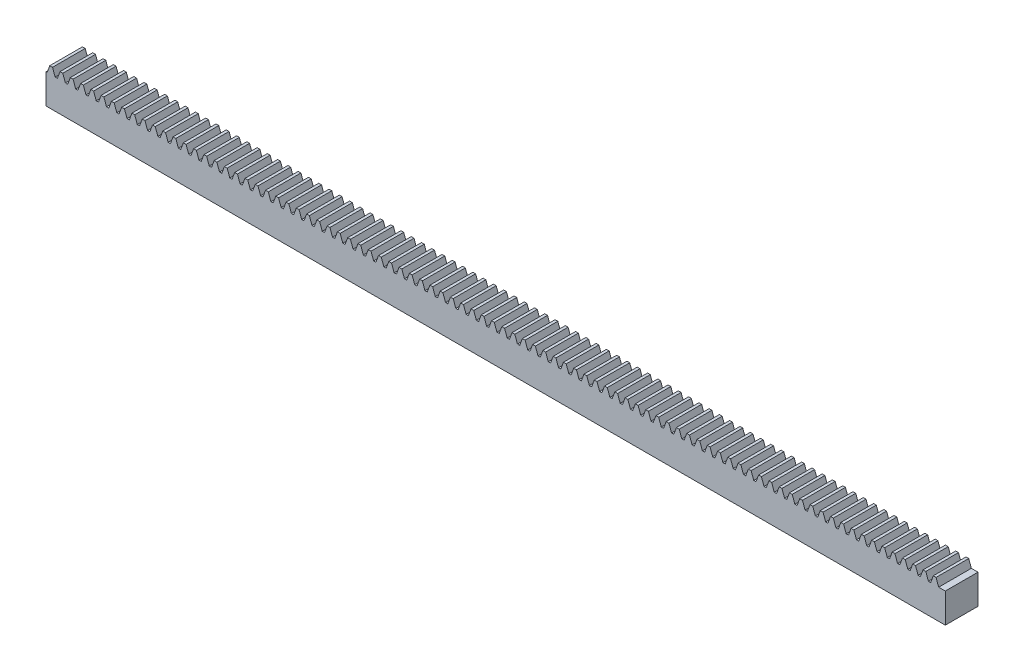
SolidWorks part; units mm, degrees
ref_plane "Plan de face" through (0, 0, 0) normal (0, 0, 1) x (1, 0, 0)
ref_plane "Plan de dessus" through (0, 0, 0) normal (0, 1, 0) x (1, 0, 0)
ref_plane "Plan de droite" through (0, 0, 0) normal (1, 0, 0) x (0, 0, -1)
ref_plane "Plan1" through (0, 0, 40) normal (0, 0, 1) x (1, 0, 0)
sketch "Esquisse1" plane through (0, 0, 40) normal (0, 0, 1) x (1, 0, 0)
  line L0 (0, 0) -> (1005, 0)
  line L1 (1005, 0) -> (1005, 62.4)
  line L2 (1005, 62.4) -> (987.299, 62.4)
  line L3 (987.299, 62.4) -> (980.8931, 80)
  line L4 (980.8931, 80) -> (974.1503, 80)
  line L5 (974.1503, 80) -> (967.7444, 62.4)
  line L6 (967.7444, 62.4) -> (962.1663, 62.4)
  line L7 (962.1663, 62.4) -> (955.7604, 80)
  line L8 (955.7604, 80) -> (949.0175, 80)
  line L9 (949.0175, 80) -> (942.6117, 62.4)
  line L10 (942.6117, 62.4) -> (937.0335, 62.4)
  line L11 (937.0335, 62.4) -> (930.6277, 80)
  line L12 (930.6277, 80) -> (923.8848, 80)
  line L13 (923.8848, 80) -> (917.4789, 62.4)
  line L14 (917.4789, 62.4) -> (911.9008, 62.4)
  line L15 (911.9008, 62.4) -> (905.4949, 80)
  line L16 (905.4949, 80) -> (898.7521, 80)
  line L17 (898.7521, 80) -> (892.3462, 62.4)
  line L18 (892.3462, 62.4) -> (886.7681, 62.4)
  line L19 (886.7681, 62.4) -> (880.3622, 80)
  line L20 (880.3622, 80) -> (873.6194, 80)
  line L21 (873.6194, 80) -> (867.2135, 62.4)
  line L22 (867.2135, 62.4) -> (861.6354, 62.4)
  line L23 (861.6354, 62.4) -> (855.2295, 80)
  line L24 (855.2295, 80) -> (848.4867, 80)
  line L25 (848.4867, 80) -> (842.0808, 62.4)
  line L26 (842.0808, 62.4) -> (836.5027, 62.4)
  line L27 (836.5027, 62.4) -> (830.0968, 80)
  line L28 (830.0968, 80) -> (823.3539, 80)
  line L29 (823.3539, 80) -> (816.9481, 62.4)
  line L30 (816.9481, 62.4) -> (811.3699, 62.4)
  line L31 (811.3699, 62.4) -> (804.9641, 80)
  line L32 (804.9641, 80) -> (798.2212, 80)
  line L33 (798.2212, 80) -> (791.8153, 62.4)
  line L34 (791.8153, 62.4) -> (786.2372, 62.4)
  line L35 (786.2372, 62.4) -> (779.8313, 80)
  line L36 (779.8313, 80) -> (773.0885, 80)
  line L37 (773.0885, 80) -> (766.6826, 62.4)
  line L38 (766.6826, 62.4) -> (761.1045, 62.4)
  line L39 (761.1045, 62.4) -> (754.6986, 80)
  line L40 (754.6986, 80) -> (747.9558, 80)
  line L41 (747.9558, 80) -> (741.5499, 62.4)
  line L42 (741.5499, 62.4) -> (735.9718, 62.4)
  line L43 (735.9718, 62.4) -> (729.5659, 80)
  line L44 (729.5659, 80) -> (722.8231, 80)
  line L45 (722.8231, 80) -> (716.4172, 62.4)
  line L46 (716.4172, 62.4) -> (710.8391, 62.4)
  line L47 (710.8391, 62.4) -> (704.4332, 80)
  line L48 (704.4332, 80) -> (697.6903, 80)
  line L49 (697.6903, 80) -> (691.2845, 62.4)
  line L50 (691.2845, 62.4) -> (685.7063, 62.4)
  line L51 (685.7063, 62.4) -> (679.3005, 80)
  line L52 (679.3005, 80) -> (672.5576, 80)
  line L53 (672.5576, 80) -> (666.1517, 62.4)
  line L54 (666.1517, 62.4) -> (660.5736, 62.4)
  line L55 (660.5736, 62.4) -> (654.1677, 80)
  line L56 (654.1677, 80) -> (647.4249, 80)
  line L57 (647.4249, 80) -> (641.019, 62.4)
  line L58 (641.019, 62.4) -> (635.4409, 62.4)
  line L59 (635.4409, 62.4) -> (629.035, 80)
  line L60 (629.035, 80) -> (622.2922, 80)
  line L61 (622.2922, 80) -> (615.8863, 62.4)
  line L62 (615.8863, 62.4) -> (610.3082, 62.4)
  line L63 (610.3082, 62.4) -> (603.9023, 80)
  line L64 (603.9023, 80) -> (597.1595, 80)
  line L65 (597.1595, 80) -> (590.7536, 62.4)
  line L66 (590.7536, 62.4) -> (585.1755, 62.4)
  line L67 (585.1755, 62.4) -> (578.7696, 80)
  line L68 (578.7696, 80) -> (572.0267, 80)
  line L69 (572.0267, 80) -> (565.6209, 62.4)
  line L70 (565.6209, 62.4) -> (560.0427, 62.4)
  line L71 (560.0427, 62.4) -> (553.6369, 80)
  line L72 (553.6369, 80) -> (546.894, 80)
  line L73 (546.894, 80) -> (540.4881, 62.4)
  line L74 (540.4881, 62.4) -> (534.91, 62.4)
  line L75 (534.91, 62.4) -> (528.5041, 80)
  line L76 (528.5041, 80) -> (521.7613, 80)
  line L77 (521.7613, 80) -> (515.3554, 62.4)
  line L78 (515.3554, 62.4) -> (509.7773, 62.4)
  line L79 (509.7773, 62.4) -> (503.3714, 80)
  line L80 (503.3714, 80) -> (496.6286, 80)
  line L81 (496.6286, 80) -> (490.2227, 62.4)
  line L82 (490.2227, 62.4) -> (484.6446, 62.4)
  line L83 (484.6446, 62.4) -> (478.2387, 80)
  line L84 (478.2387, 80) -> (471.4959, 80)
  line L85 (471.4959, 80) -> (465.09, 62.4)
  line L86 (465.09, 62.4) -> (459.5119, 62.4)
  line L87 (459.5119, 62.4) -> (453.106, 80)
  line L88 (453.106, 80) -> (446.3631, 80)
  line L89 (446.3631, 80) -> (439.9573, 62.4)
  line L90 (439.9573, 62.4) -> (434.3791, 62.4)
  line L91 (434.3791, 62.4) -> (427.9733, 80)
  line L92 (427.9733, 80) -> (421.2304, 80)
  line L93 (421.2304, 80) -> (414.8245, 62.4)
  line L94 (414.8245, 62.4) -> (409.2464, 62.4)
  line L95 (409.2464, 62.4) -> (402.8405, 80)
  line L96 (402.8405, 80) -> (396.0977, 80)
  line L97 (396.0977, 80) -> (389.6918, 62.4)
  line L98 (389.6918, 62.4) -> (384.1137, 62.4)
  line L99 (384.1137, 62.4) -> (377.7078, 80)
  line L100 (377.7078, 80) -> (370.965, 80)
  line L101 (370.965, 80) -> (364.5591, 62.4)
  line L102 (364.5591, 62.4) -> (358.981, 62.4)
  line L103 (358.981, 62.4) -> (352.5751, 80)
  line L104 (352.5751, 80) -> (345.8323, 80)
  line L105 (345.8323, 80) -> (339.4264, 62.4)
  line L106 (339.4264, 62.4) -> (333.8483, 62.4)
  line L107 (333.8483, 62.4) -> (327.4424, 80)
  line L108 (327.4424, 80) -> (320.6995, 80)
  line L109 (320.6995, 80) -> (314.2937, 62.4)
  line L110 (314.2937, 62.4) -> (308.7155, 62.4)
  line L111 (308.7155, 62.4) -> (302.3097, 80)
  line L112 (302.3097, 80) -> (295.5668, 80)
  line L113 (295.5668, 80) -> (289.1609, 62.4)
  line L114 (289.1609, 62.4) -> (283.5828, 62.4)
  line L115 (283.5828, 62.4) -> (277.1769, 80)
  line L116 (277.1769, 80) -> (270.4341, 80)
  line L117 (270.4341, 80) -> (264.0282, 62.4)
  line L118 (264.0282, 62.4) -> (258.4501, 62.4)
  line L119 (258.4501, 62.4) -> (252.0442, 80)
  line L120 (252.0442, 80) -> (245.3014, 80)
  line L121 (245.3014, 80) -> (238.8955, 62.4)
  line L122 (238.8955, 62.4) -> (233.3174, 62.4)
  line L123 (233.3174, 62.4) -> (226.9115, 80)
  line L124 (226.9115, 80) -> (220.1687, 80)
  line L125 (220.1687, 80) -> (213.7628, 62.4)
  line L126 (213.7628, 62.4) -> (208.1847, 62.4)
  line L127 (208.1847, 62.4) -> (201.7788, 80)
  line L128 (201.7788, 80) -> (195.0359, 80)
  line L129 (195.0359, 80) -> (188.6301, 62.4)
  line L130 (188.6301, 62.4) -> (183.0519, 62.4)
  line L131 (183.0519, 62.4) -> (176.6461, 80)
  line L132 (176.6461, 80) -> (169.9032, 80)
  line L133 (169.9032, 80) -> (163.4973, 62.4)
  line L134 (163.4973, 62.4) -> (157.9192, 62.4)
  line L135 (157.9192, 62.4) -> (151.5133, 80)
  line L136 (151.5133, 80) -> (144.7705, 80)
  line L137 (144.7705, 80) -> (138.3646, 62.4)
  line L138 (138.3646, 62.4) -> (132.7865, 62.4)
  line L139 (132.7865, 62.4) -> (126.3806, 80)
  line L140 (126.3806, 80) -> (119.6378, 80)
  line L141 (119.6378, 80) -> (113.2319, 62.4)
  line L142 (113.2319, 62.4) -> (107.6538, 62.4)
  line L143 (107.6538, 62.4) -> (101.2479, 80)
  line L144 (101.2479, 80) -> (94.5051, 80)
  line L145 (94.5051, 80) -> (88.0992, 62.4)
  line L146 (88.0992, 62.4) -> (82.5211, 62.4)
  line L147 (82.5211, 62.4) -> (76.1152, 80)
  line L148 (76.1152, 80) -> (69.3723, 80)
  line L149 (69.3723, 80) -> (62.9665, 62.4)
  line L150 (62.9665, 62.4) -> (57.3883, 62.4)
  line L151 (57.3883, 62.4) -> (50.9825, 80)
  line L152 (50.9825, 80) -> (44.2396, 80)
  line L153 (44.2396, 80) -> (37.8337, 62.4)
  line L154 (37.8337, 62.4) -> (32.2556, 62.4)
  line L155 (32.2556, 62.4) -> (25.8497, 80)
  line L156 (25.8497, 80) -> (19.1069, 80)
  line L157 (19.1069, 80) -> (12.701, 62.4)
  line L158 (12.701, 62.4) -> (0, 62.4)
  line L159 (0, 62.4) -> (0, 0)
extrude "Boss.-Extru.1" add sketch "Esquisse1" against normal blind 80
sketch "Esquisse2" plane through (0, 0, 40) normal (0, 0, 1) x (1, 0, 0)
  line L0 (0, 0) -> (1005, 0) construction
  line L1 (0, 62.4) -> (9.911, 62.4)
  line L2 (0, 62.4) -> (0, 0)
  line L3 (0, 0) -> (9.911, 0)
  line L4 (9.911, 62.4) -> (9.911, 0)
  line L6 (1005, 62.4) -> (990.089, 62.4)
  line L7 (1005, 62.4) -> (1005, 0)
  line L8 (1005, 0) -> (990.089, 0)
  line L9 (990.089, 62.4) -> (990.089, 0)
  dimension "D1" = 2.79
  dimension "D2" = 2.79
extrude "Enlèv. mat.-Extru.1" cut sketch "Esquisse2" against normal through all
mirror "Symétrie1" about plane through (990.089, 62.4, -40) normal (-1, 0, 0) of "Boss.-Extru.1", "Enlèv. mat.-Extru.1"
mirror "Symétrie2" about plane through (1970.2669, 62.4, -40) normal (-1, 0, 0) of "Symétrie1", "Boss.-Extru.1", "Enlèv. mat.-Extru.1"
sketch "Esquisse3" plane through (0, 0, 40) normal (0, 0, 1) x (1, 0, 0)
  line L0 (2209.911, 276.2255) -> (2209.911, -281.9654)
  line L1 (9.911, 0) -> (9.911, 62.4) construction
  dimension "D1" = 2200
extrude "Enlèv. mat.-Extru.2" cut sketch "Esquisse3" against normal through all and the other way through all
sketch "Esquisse4" plane through (0, 0, 0) normal (0, -1, 0) x (1, 0, 0)
  line L4 (9.911, -40) -> (2209.911, -40)
  line L5 (2209.911, -40) -> (2209.911, 40)
  line L6 (2209.911, 40) -> (9.911, 40)
  line L7 (9.911, 40) -> (9.911, -40)
  line L8 (9.911, -40) -> (2209.911, -40)
  line L9 (2209.911, -40) -> (2209.911, 40)
  line L10 (2209.911, 40) -> (9.911, 40)
  line L11 (9.911, 40) -> (9.911, -40)
  dimension "D1" = 0
extrude "Boss.-Extru.2" add sketch "Esquisse4" along normal blind 10
hole_wizard "Trou taraudé M20x2.01" positions "Esquisse6" profile "Esquisse5" tap size "M20x2.0" standard "ISO"
sketch "Esquisse6" plane through (0, -10, 0) normal (0, -1, 0) x (1, 0, 0)
  line L0 (49.5, 0) -> (-49.5, 0) construction
  line L1 (9.911, 40) -> (9.911, -40) construction
  point P0 (29.911, 0)
  point P34 (409.911, 0)
  point P35 (779.911, 0)
  point P41 (1179.911, 0)
  point P47 (1549.911, 0)
  point P48 (1919.911, 0)
  dimension "D1" = 20
sketch "Esquisse5" plane through (29.911, -10, 0) normal (1, 0, 0) x (0, 0, -1)
  line L0 (0, 0) -> (0, 45.4077)
  line L1 (0, 45.4077) -> (9, 40)
  line L2 (9, 40) -> (9, 0)
  line L5 (9, 0) -> (0, 0)
  line L10 (0, 45.4077) -> (-9, 40) construction
  line L11 (0, -6.35) -> (0, 107.95) construction
  dimension "Diamètre du trou pour taraudage" = 18
  dimension "Profondeur du trou pour taraudage" = 40
  dimension "Angle de pointe" = 118
sketch "Esquisse7" plane through (0, 0, 40) normal (0, 0, 1) x (1, 0, 0)
  line L1 (2199.2514, 62.4) -> (2209.911, 62.4)
  line L2 (2199.2514, 62.4) -> (2199.2514, 80)
  line L3 (2199.2514, 80) -> (2209.911, 80)
  line L4 (2209.911, 62.4) -> (2209.911, 80)
extrude "Enlèv. mat.-Extru.3" cut sketch "Esquisse7" against normal through all
